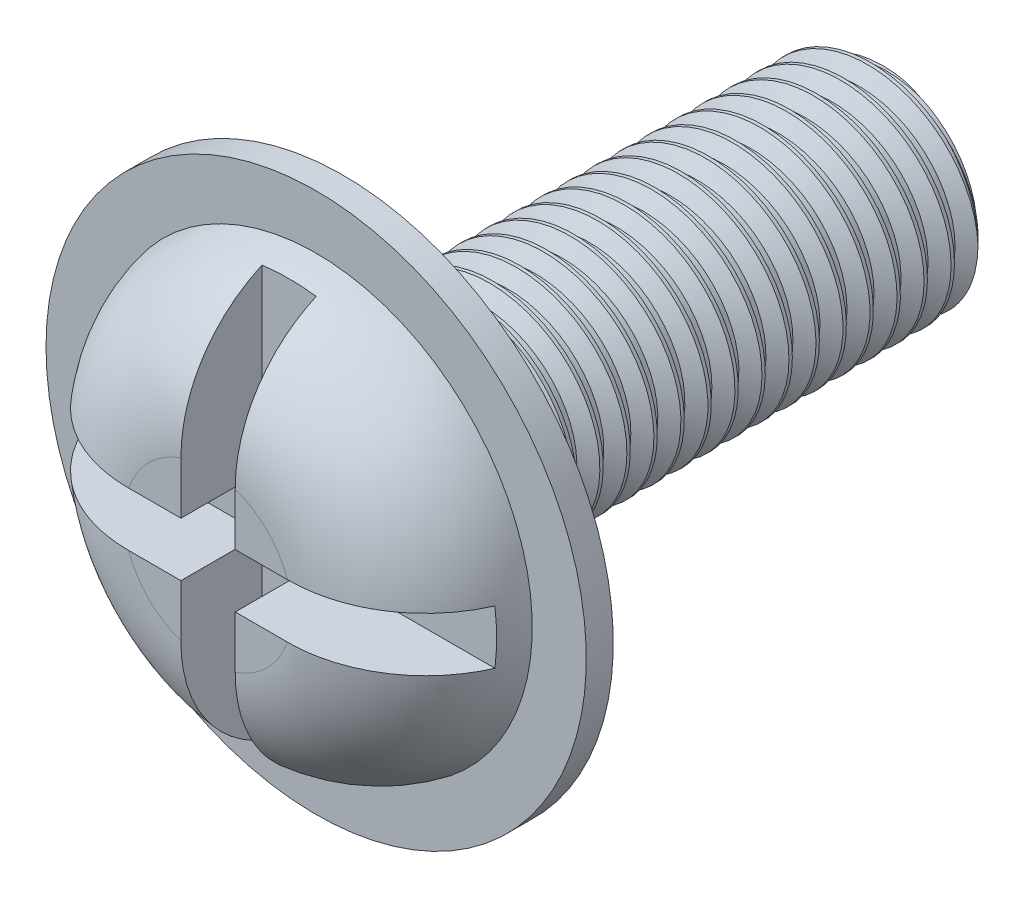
SolidWorks part; units mm, degrees
ref_plane "Плоскость1" through (0, 0, 0) normal (0, 0, 1) x (1, 0, 0)
ref_plane "Плоскость2" through (0, 0, 0) normal (0, 1, 0) x (1, 0, 0)
ref_plane "Плоскость3" through (0, 0, 0) normal (1, 0, 0) x (0, 0, -1)
sketch "Эскиз1" plane through (0, 0, 0) normal (0, 0, 1) x (1, 0, 0)
  circle A0 centre (0, 0) radius 4
  dimension "D1" = 8
extrude "Основание-Вытянуть" add sketch "Эскиз1" along normal blind 21
sketch "Эскиз2" plane through (0, 0, 21) normal (0, 0, 1) x (1, 0, 0)
  circle A0 centre (0, 0) radius 8
  dimension "D1" = 16
extrude "Бобышка-Вытянуть1" add sketch "Эскиз2" along normal blind 4
fillet "Скругление1" radius 5 1 edges at (8, 0, 25)
chamfer "Фаска1" distance 0.5 angle 45 1 edges at (4, 0, 0)
sketch "Эскиз3" plane through (0, 0, 25) normal (0, 0, 1) x (1, 0, 0)
  line L0 (0, 0) -> (0, 44.3713) construction
  line L1 (1.0048, 1) -> (10.0296, 1)
  line L2 (-10.0296, 1) -> (-1.0048, 1)
  line L3 (-10.0296, -1) -> (-1.0048, -1)
  line L4 (10.0296, 1) -> (10.0296, -1)
  line L5 (-10.0296, 1) -> (-10.0296, -1)
  line L6 (-1.0048, 10.0249) -> (1.0048, 10.0249)
  line L7 (-1.0048, 10.0249) -> (-1.0048, 1)
  line L8 (-1.0048, -10.0249) -> (1.0048, -10.0249)
  line L9 (1.0048, 10.0249) -> (1.0048, 1)
  line L10 (1.0048, -1) -> (1.0048, -10.0249)
  line L11 (-1.0048, -1) -> (-1.0048, -10.0249)
  line L12 (1.0048, -1) -> (10.0296, -1)
  line L13 (0, -10.0249) -> (0, 10.0249) construction
  line L14 (10.0296, 0) -> (-10.0296, 0) construction
extrude "Вырез-Вытянуть1" cut sketch "Эскиз3" against normal blind 3
sketch "Эскиз4" plane through (0, 0, 21) normal (0, 0, -1) x (-1, 0, 0)
  circle A0 centre (0, 0) radius 10
  dimension "D1" = 20
extrude "Бобышка-Вытянуть2" add sketch "Эскиз4" along normal blind 1
thread "Резьба1" pitch 1 start angle 0, offset 1, length 20, pitch 1, diameter 8
ref_plane "Плоскость4" through (4, 0, -0.5) normal (0, -1, 0) x (1, 0, 0)
sketch "Профиль резьбы1" plane through (4, 0, -0.5) normal (0, -1, 0) x (1, 0, 0)
  line L0 (0, 0) -> (0, 1) construction
  line L11 (0, 0) -> (0, 0.875)
  line L12 (0, 0.875) -> (-0.5413, 0.5625)
  line L13 (-0.5413, 0.5625) -> (-0.5413, 0.3125)
  line L15 (-0.5413, 0.3125) -> (0, 0)
  line L17 (-0.5413, 0.4375) -> (0, 0.4375) construction
  point P2 (0, 0)
  dimension "Pitch" = 1
  dimension "Profile_Angle" = 60
  dimension "Profile_Land" = 0.25
  dimension "Profile_Height" = 0.5413
